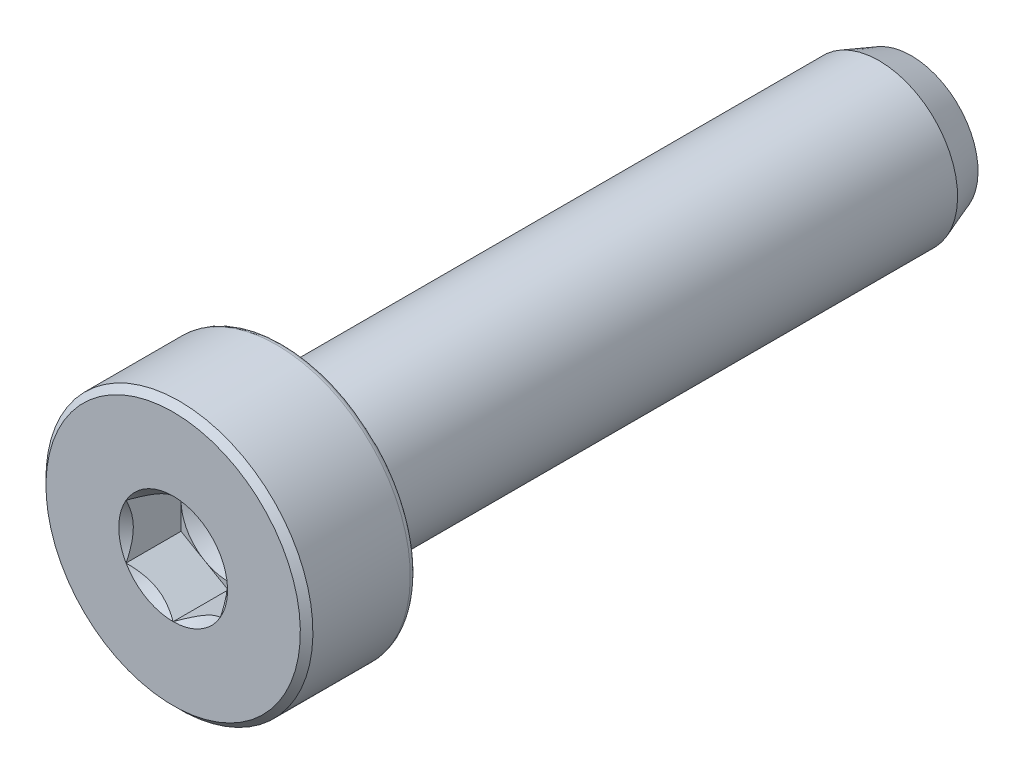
SolidWorks part; units mm, degrees
ref_plane "Front" through (0, 0, 0) normal (0, 0, 1) x (1, 0, 0)
ref_plane "Top" through (0, 0, 0) normal (0, 1, 0) x (1, 0, 0)
ref_plane "Right" through (0, 0, 0) normal (1, 0, 0) x (0, 0, -1)
sketch "Sketch1" plane through (0, 0, 0) normal (1, 0, 0) x (0, 0, -1)
  line L0 (0, 0) -> (-3.5, 0) construction
  line L1 (0, 0) -> (20, 0)
  line L2 (0, 0) -> (0, 2.5)
  line L3 (0, 2.5) -> (20, 2.5)
  line L4 (20, 0) -> (20, 2.5)
  line L5 (0, -2.5) -> (20, -2.5) construction
  line L6 (-3.5, 4.25) -> (-3.5, -4.25) construction
  line L7 (-3.5, 0) -> (-7, 0) construction
revolve "Revolve1" add sketch "Sketch1" angle 360 about L0
sketch "Sketch2" plane through (0, 0, 0) normal (1, 0, 0) x (0, 0, -1)
  line L0 (0, 2.5) -> (0, -2.5) construction
  line L1 (0, -2.5) -> (0.8, -2.5) construction
  line L2 (0.8, -2.5) -> (0, 2.5) construction
  line L3 (0, 2.5) -> (0.0987, 2.5158) construction
  line L4 (0.0987, 2.5158) -> (0.79, 2.6264)
  line L5 (0.79, 2.6264) -> (0.6115, 2.1593)
  line L6 (0.6115, 2.1593) -> (0.414, 2.1277)
  line L7 (0.414, 2.1277) -> (0.0987, 2.5158)
  line L8 (0.5128, 2.1435) -> (0.4443, 2.5711) construction
  line L9 (0, -2.5) -> (20, -2.5) construction
  line L10 (0, 2.5) -> (20, 2.5) construction
  line L12 (0.4557, 2.5) -> (1.2557, -2.5) construction
  line L13 (0, -0.1369) -> (1.7114, 0.1369) construction
  line L15 (0, 0) -> (0, 2.5) construction
  point P19 (0.8557, 0)
revolve "Cut-Revolve1" [suppressed] cut sketch "Sketch2" angle 360 about L13
sketch "Sketch3" plane through (0, 0, 0) normal (1, 0, 0) x (0, 0, -1)
  line L0 (20, 2.1277) -> (18.9772, 2.5)
  line L1 (18.9772, 2.5) -> (20, 2.5)
  line L2 (20, 2.5) -> (20, 2.1277)
  line L3 (0, 2.5) -> (20, 2.5) construction
  line L4 (20, 0) -> (20, 2.5) construction
  line L5 (18.9772, 0) -> (0, 0) construction
  line L6 (18.9772, 2.5) -> (18.9772, -2.5) construction
  line L7 (0, -2.5) -> (20, -2.5) construction
  dimension "D1" = 20
  dimension "D2" = 5
revolve "Cut-Revolve2" cut sketch "Sketch3" angle 360 about L5
pattern_linear "LPattern1" [suppressed] count 25 spacing 0.8 along (0, 0, 1) count 2 spacing 0.8 along (0, 0, 1)
ref_plane "Plane1" through (0, 0, 0) normal (0, 0, 1) x (1, 0, 0)
sketch "Sketch4" plane through (0, 0, 0) normal (0, 0, 1) x (1, 0, 0)
  circle A0 centre (0, 0) radius 4.25
  dimension "D1" = 8.5
extrude "Extrude1" add sketch "Sketch4" along normal up to vertex (3.5 mm away)
sketch "Sketch10" plane through (0, 0, 0) normal (1, 0, 0) x (0, 0, -1)
  line L0 (-3.5, 4.05) -> (-3.3, 4.25)
  line L1 (-3.3, 4.25) -> (-0.2, 4.25)
  line L2 (0, 4.05) -> (0.1, 4.05)
  line L3 (0.1, 4.05) -> (0.1, 4.35)
  line L4 (0.1, 4.35) -> (-3.5, 4.35)
  line L5 (-3.5, 4.35) -> (-3.5, 4.05)
  line L7 (0, 4.25) -> (-3.5, 4.25) construction
  line L9 (0, 4.05) -> (-3.5, 4.05) construction
  line L10 (-3.5, 0) -> (-7, 0) construction
  line L11 (0, -4.25) -> (0, 4.25) construction
  line L12 (-3.5, 4.25) -> (-3.5, -4.25) construction
  arc A0 (-0.2, 4.25) -> (0, 4.05) centre (-0.2, 4.05) cw
revolve "Cut-Revolve3" cut sketch "Sketch10" angle 360 about L10
sketch "Sketch6" plane through (0, 0, 3.5) normal (0, 0, 1) x (1, 0, 0)
  line L1 (0, -1.7321) -> (1.5, -0.866)
  line L2 (1.5, -0.866) -> (1.5, 0.866)
  line L3 (1.5, 0.866) -> (0, 1.7321)
  line L4 (0, 1.7321) -> (-1.5, 0.866)
  line L5 (-1.5, 0.866) -> (-1.5, -0.866)
  line L6 (-1.5, -0.866) -> (0, -1.7321)
  circle A0 centre (0, 0) radius 1.5 construction
  dimension "Hex" = 3
extrude "Cut-Extrude1" cut sketch "Sketch6" against normal blind 1.75
sketch "Sketch7" plane through (0, 0, 3.5) normal (0, 0, 1) x (1, 0, 0)
  circle A0 centre (0, 0) radius 1.7321
extrude "Cut-Extrude4" cut sketch "Sketch7" against normal blind 1.75 draft 45
sketch "Sketch8" plane through (0, 0, 1.75) normal (0, 0, 1) x (1, 0, 0)
  circle A0 centre (0, 0) radius 1.5 construction
  circle A1 centre (0, 0) radius 1.5
extrude "Cut-Extrude5" cut sketch "Sketch8" against normal blind 0.5833 draft 60
equation "\"D2@Sketch2\"=\"Thread Pitch@Sketch2\"/8"
equation "\"D3@Sketch2\"=\"Thread Pitch@Sketch2\"/4"
equation "\"D4@Sketch2\"=\"Thread Pitch@Sketch2\""
equation "\"D3@LPattern1\"=\"Thread Pitch@Sketch2\""
equation "\"D1@Cut-Extrude4\"=\"D1@Cut-Extrude1\""
equation "\"D1@Cut-Extrude5\"=\"D1@Cut-Extrude1\"/3"
equation "\"D1@LPattern1\"=\"Min Thread Length@Sketch1\"/\"Thread Pitch@Sketch2\""
equation "\"D4@LPattern1\"=\"Thread Pitch@Sketch2\""
equation "\"D4@Sketch10\"=\"Thread Dia@Sketch1\"/25"
equation "\"D1@Cut-Extrude1\"=\"Head Height@Sketch1\"/2"
